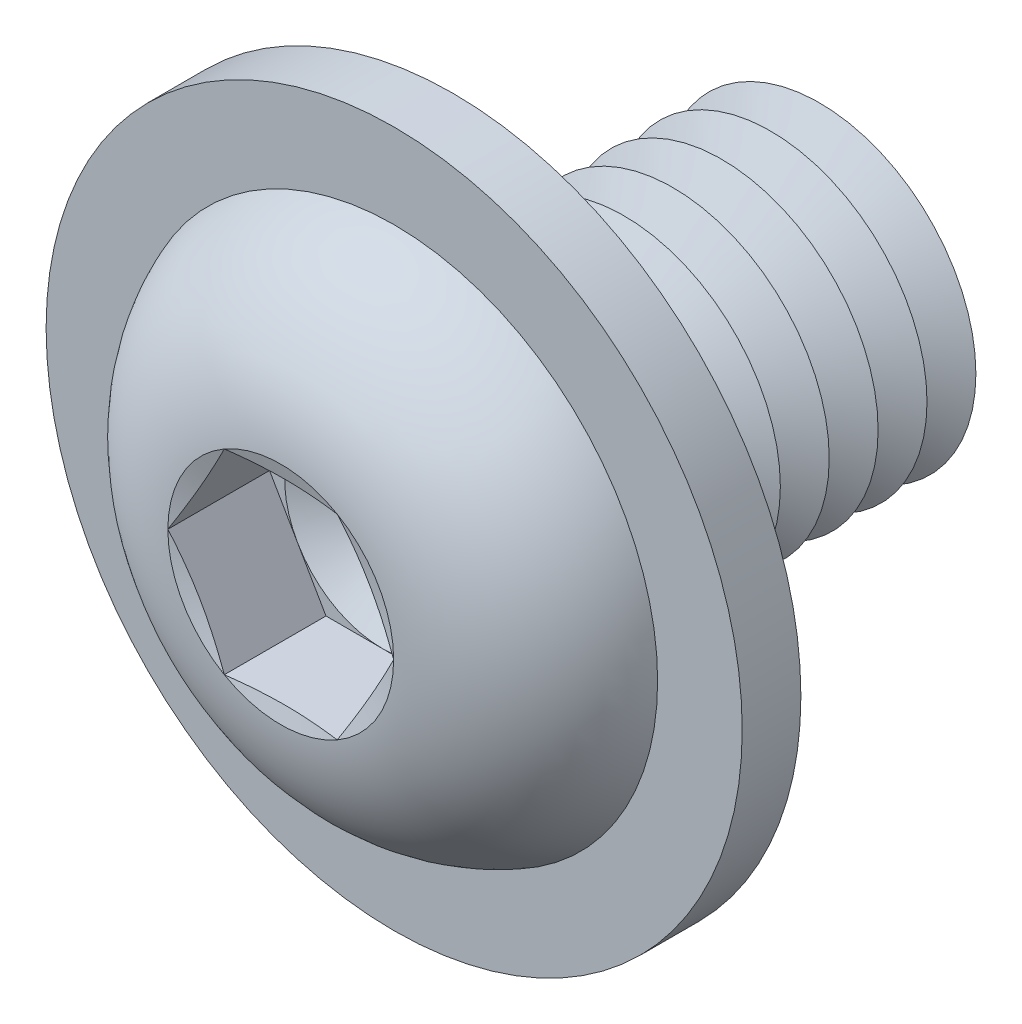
SolidWorks part; units mm, degrees
ref_plane "Front Plane" through (0, 0, 0) normal (0, 0, 1) x (1, 0, 0)
ref_plane "Top Plane" through (0, 0, 0) normal (0, 1, 0) x (1, 0, 0)
ref_plane "Right Plane" through (0, 0, 0) normal (1, 0, 0) x (0, 0, -1)
sketch "Sketch1" plane through (0, 0, 0) normal (1, 0, 0) x (0, 0, -1)
  line L0 (0, 4) -> (0, 7)
  line L3 (0, 4) -> (10, 4)
  line L4 (10, 4) -> (10, 0)
  line L5 (10, 0) -> (-4.4, 0) construction
  line L6 (-4.4, 0) -> (10, 0)
  line L7 (-4.4, 2.8867) -> (-4.4, 1.4434) construction
  line L8 (-4.4, 1.4434) -> (-4.4, 0)
  line L9 (-4.4, 2.8867) -> (-4.0132, 1.4434)
  line L10 (-4.0132, 1.4434) -> (-4.4, 1.4434)
  line L11 (10, 0) -> (22.7481, 0) construction
  line L12 (0, 7) -> (-4.4, 7) construction
  arc A1 (0, 7) -> (-4.4, 2.8867) centre (0, 2.59) ccw
  point P8 (10, 2)
  dimension "D1" = 14
  dimension "D2" = 8
  dimension "D3" = 4.4
  dimension "D4" = 5.7735
  dimension "D5" = 10
  dimension "D6" = 15
revolve "Revolve1" add sketch "Sketch1" angle 360 about L5
fillet "Fillet1" radius 0.625 1 edges at (-4, 0, 0)
sketch "Sketch2" plane through (0, 0, 0) normal (1, 0, 0) x (0, 0, -1)
  line L0 (9.375, 4) -> (10.625, 4)
  line L1 (10, 4) -> (0.625, 4) construction
  line L2 (10.625, 4) -> (10, 2.9175)
  line L3 (10, -4) -> (10, 4) construction
  line L4 (10, 2.9175) -> (9.375, 4)
  dimension "D1" = 1.25
revolve "Cut-Revolve1" cut sketch "Sketch2" angle 360 about axis through (0, 0, -10) along (0, 0, -1)
pattern_linear "LPattern1" count 8 spacing 1.25 along (0, 0, 1) of "Cut-Revolve1"
sketch "Sketch3" plane through (0, 0, 4.4) normal (0, 0, 1) x (1, 0, 0)
  line L7 (1.4434, 2.5) -> (-1.4434, 2.5)
  line L8 (-1.4434, 2.5) -> (-2.8867, 0)
  line L9 (-2.8867, 0) -> (-1.4434, -2.5)
  line L10 (-1.4434, -2.5) -> (1.4434, -2.5)
  line L11 (1.4434, -2.5) -> (2.8867, 0)
  line L12 (2.8867, 0) -> (1.4434, 2.5)
  circle A0 centre (0, 0) radius 2.5 construction
  circle A3 centre (0, 0) radius 2.8867 construction
extrude "Cut-Extrude1" cut sketch "Sketch3" against normal blind 2.6
sketch "Sketch4" plane through (0, 0, 1.8) normal (0, 0, 1) x (1, 0, 0)
  line L1 (1.4434, 2.5) -> (-1.4434, 2.5) construction
  circle A0 centre (0, 0) radius 2.5
extrude "Cut-Extrude2" cut sketch "Sketch4" against normal through all draft 60
sketch "Sketch5" plane through (0, 0, 0) normal (0, 0, -1) x (-1, 0, 0)
  circle A0 centre (0, 0) radius 8.9
  circle A1 centre (0, 0) radius 4.625
  circle A2 centre (0, 0) radius 4.625 construction
  dimension "D1" = 17.8
extrude "Boss-Extrude1" add sketch "Sketch5" against normal blind 1.5
